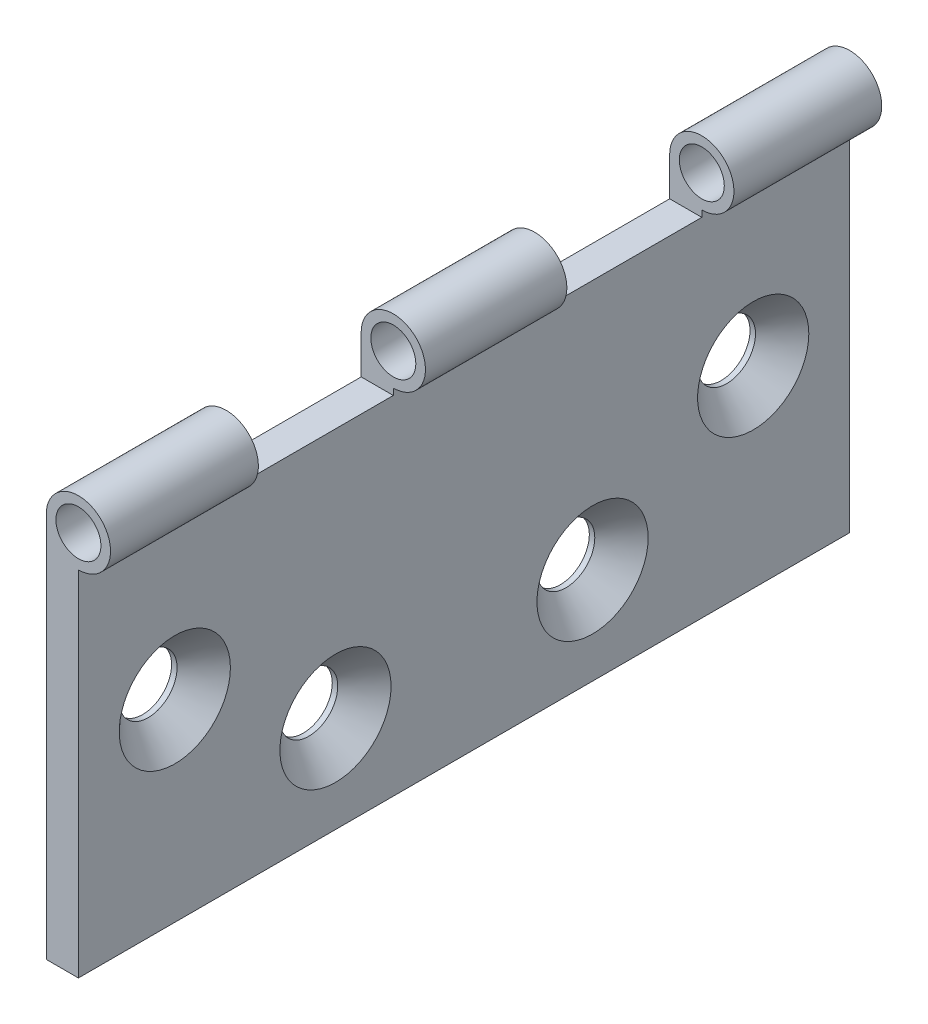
SolidWorks part; units mm, degrees
ref_plane "Front Plane" through (0, 0, 0) normal (0, 0, 1) x (1, 0, 0)
ref_plane "Top Plane" through (0, 0, 0) normal (0, 1, 0) x (1, 0, 0)
ref_plane "Right Plane" through (0, 0, 0) normal (1, 0, 0) x (0, 0, -1)
sketch "Sketch1" plane through (0, 0, 0) normal (0, 0, 1) x (1, 0, 0)
  line L0 (0, 0) -> (0, 60)
  dimension "D1" = 60
extrude "Extrude-Thin1" add sketch "Sketch1" along normal mid plane 120 thin
sketch "Sketch2" plane through (0, 0, 60) normal (0, 0, 1) x (1, 0, 0)
  circle A0 centre (5, 60) radius 5
  dimension "D1" = 10
sweep "Sweep1" add profiles "Sketch2"
sketch "Sketch3" plane through (0, 0, 60) normal (0, 0, 1) x (1, 0, 0)
  circle A0 centre (5, 60) radius 3.5
  dimension "D1" = 7
extrude "Cut-Extrude1" cut sketch "Sketch3" against normal through all
hole_wizard "CSK for M8 Flat Head Machine Screw2" positions "3DSketch1" profile "Sketch6" countersink size "M8" standard "Ansi Metric"
sketch3d "3DSketch1"
  line L0 (5, 0, 60) -> (5, 55, 60) construction
  line L1 (5, 0, 60) -> (5, 0, -60) construction
  point P0 (5, 30, 45)
  point P2 (5, 15, 20)
  dimension "D1" = 15
  dimension "D2" = 30
  dimension "D3" = 15
  dimension "D4" = 40
sketch "Sketch6" plane through (5, 30, 45) normal (0, 1, 0) x (0, 0, -1)
  line L0 (0, 0) -> (0, 5)
  line L1 (0, 5) -> (4.5, 5)
  line L2 (4.5, 5) -> (4.5, 4.15)
  line L3 (4.5, 4.15) -> (8.65, 0)
  line L5 (8.65, 0) -> (0, 0)
  line L6 (-4.5, 4.15) -> (-8.65, 0) construction
  line L11 (0, -6.35) -> (0, 107.95) construction
  dimension "Thru Hole Dia." = 9
  dimension "Thru Hole Depth" = 5
  dimension "Near C'Sink Dia." = 17.3
  dimension "Near C'Sink Angle" = 90
mirror "Mirror1" about plane through (0, 0, 0) normal (0, 0, 1) of "CSK for M8 Flat Head Machine Screw2"
sketch "layout for cuts" plane through (5, 0, 0) normal (1, 0, 0) x (0, 0, -1)
  line L1 (60, 55) -> (60, 65) construction
  line L2 (60, 54) -> (-60, 54)
  line L3 (60, 54) -> (-60, 54)
  line L4 (-60, 65) -> (-60, 55) construction
  line L5 (60, 54) -> (60, 65)
  line L6 (-60, 65) -> (-60, 54)
  line L7 (-60, 65) -> (60, 65)
  line L8 (-36, 65) -> (-36, 54)
  line L9 (-12, 65) -> (-12, 54)
  line L10 (0, 0) -> (0, 100) construction
  line L11 (-60, 0) -> (60, 0) construction
  line L12 (12, 65) -> (12, 54)
  line L13 (36, 65) -> (36, 54)
  dimension "D2" = 24
  dimension "D3" = 24
  dimension "D1" = 1
sketch "Sketch12" plane through (5, 0, 0) normal (1, 0, 0) x (0, 0, -1)
  line L2 (-37, 65) -> (-37, 54)
  line L3 (-37, 65) -> (-37, 54)
  line L4 (-60, 54) -> (60, 54)
  line L5 (-60, 65) -> (-60, 54)
  line L6 (60, 65) -> (-60, 65)
  line L7 (60, 54) -> (60, 65)
  line L8 (-37, 54) -> (-11, 54)
  line L10 (37, 65) -> (11, 65)
  line L11 (-11, 65) -> (-37, 65)
  line L13 (37, 65) -> (37, 54)
  line L14 (37, 65) -> (37, 54)
  line L16 (-11, 65) -> (-11, 54)
  line L17 (-11, 65) -> (-11, 54)
  line L18 (11, 54) -> (37, 54)
  line L19 (11, 65) -> (11, 54)
  line L20 (11, 65) -> (11, 54)
  dimension "D1" = 0
  dimension "D2" = 1
  dimension "D3" = 1
  dimension "D4" = 1
  dimension "D5" = 1
extrude "2Cuts" cut sketch "Sketch12" against normal through all and the other way through all
sketch "Sketch10" plane through (5, 0, 0) normal (1, 0, 0) x (0, 0, -1)
  line L2 (-35, 65) -> (-35, 54)
  line L3 (-35, 65) -> (-35, 54)
  line L4 (-60, 54) -> (60, 54)
  line L5 (-60, 65) -> (-60, 54)
  line L6 (60, 65) -> (-60, 65)
  line L7 (60, 54) -> (60, 65)
  line L8 (-60, 54) -> (-35, 54)
  line L9 (-60, 65) -> (-60, 54)
  line L10 (60, 65) -> (35, 65)
  line L11 (60, 54) -> (60, 65)
  line L13 (35, 65) -> (35, 54)
  line L14 (35, 65) -> (35, 54)
  line L23 (-13, 65) -> (-13, 54)
  line L24 (-13, 65) -> (-13, 54)
  line L25 (-35, 65) -> (-60, 65)
  line L26 (13, 65) -> (13, 54)
  line L27 (13, 65) -> (13, 54)
  line L28 (-13, 54) -> (13, 54)
  line L29 (13, 65) -> (-13, 65)
  line L30 (35, 54) -> (60, 54)
  dimension "D1" = 0
  dimension "D2" = 1
  dimension "D3" = 1
  dimension "D4" = 1
  dimension "D5" = 1
extrude "3Cuts" [suppressed] cut sketch "Sketch10" against normal through all and the other way through all
equation "\"D2@3DSketch1\" = \"D1@Sketch1\" / 2"
equation "\"D4@3DSketch1\" = \"D1@Extrude-Thin1\" / 3"
equation "\"D2@layout for cuts\" = \"D1@Extrude-thin1\"/5"
equation "\"D3@layout for cuts\"=\"D1@Extrude-thin1\"/5"
